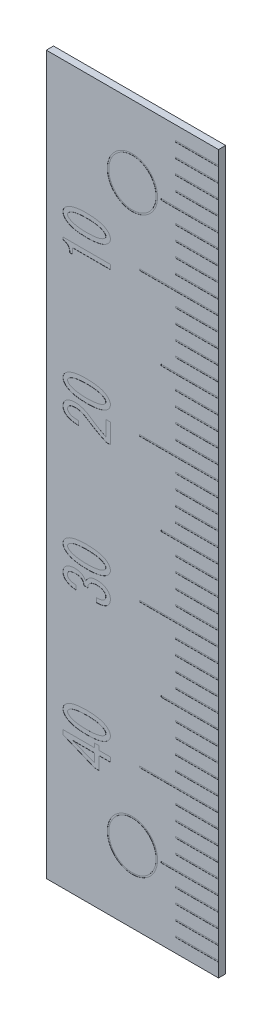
SolidWorks part; units mm, degrees
ref_plane "Front" through (0, 0, 0) normal (0, 0, 1) x (1, 0, 0)
ref_plane "Top" through (0, 0, 0) normal (0, 1, 0) x (1, 0, 0)
ref_plane "Right" through (0, 0, 0) normal (1, 0, 0) x (0, 0, -1)
sketch "Sketch1" plane through (0, 0, 0) normal (0, 0, 1) x (1, 0, 0)
  line L1 (0, 0) -> (0, 50)
  line L2 (0, 0) -> (12, 0)
  line L3 (12, 0) -> (12, 50)
  line L4 (0, 50) -> (12, 50)
  dimension "D1" = 50
  dimension "D2" = 12
extrude "Extrude1" add sketch "Sketch1" along normal blind 0.5
sketch "Sketch2" plane through (0, 0, 0.5) normal (0, 0, 1) x (1, 0, 0)
  line L0 (0, 50) -> (0, 0) construction
  line L1 (0, 0) -> (12, 0) construction
  line L2 (12, 50) -> (0, 50) construction
  circle A0 centre (6, 5) radius 1.75
  circle A1 centre (6, 45) radius 1.75
  circle A2 centre (6, 5) radius 1.65
  circle A3 centre (6, 45) radius 1.65
  dimension "D1" = 6
  dimension "D2" = 6
  dimension "D3" = 5
  dimension "D4" = 5
  dimension "D5" = 3.5
  dimension "D6" = 3.5
  dimension "D7" = 0.1
extrude "Extrude2" cut sketch "Sketch2" against normal blind 0.01
sketch "Sketch3" plane through (0, 0, 0.5) normal (0, 0, 1) x (1, 0, 0)
  line L0 (12, 50) -> (0, 50) construction
  line L1 (1, 38.25) -> (4.5, 38.25) construction
  line L2 (1, 38.25) -> (1, 41.75) construction
  line L3 (1, 41.75) -> (4.5, 41.75) construction
  line L4 (4.5, 38.25) -> (4.5, 41.75) construction
  line L5 (0, 50) -> (0, 0) construction
  line L6 (4.5, 28.25) -> (4.5, 31.75) construction
  line L7 (4.5, 18.25) -> (4.5, 21.75) construction
  line L8 (4.5, 8.25) -> (4.5, 11.75) construction
  text T0 "10" font "ＭＳ ゴシック" height in points 11
  text T1 "20" font "ＭＳ ゴシック" height in points 11
  text T2 "30" font "ＭＳ ゴシック" height in points 11
  text T3 "40" font "ＭＳ ゴシック" height in points 11
  point P4 (4.5, 40)
  dimension "D1" = 3.5
  dimension "D2" = 10
  dimension "D3" = 1
  dimension "D4" = 3.5
  dimension "D5" = 4
extrude "Extrude3" cut sketch "Sketch3" against normal blind 0.01
sketch "Sketch4" plane through (0, 0, 0.5) normal (0, 0, 1) x (1, 0, 0)
  line L0 (12, 40.05) -> (6.5, 40.05)
  line L1 (12, 0) -> (12, 50) construction
  line L2 (6.5, 40.05) -> (6.5, 39.95)
  line L3 (6.5, 39.95) -> (12, 39.95)
  line L4 (12, 39.95) -> (12, 40.05)
  line L5 (12, 50) -> (0, 50) construction
  line L6 (12, 48.05) -> (12, 47.95)
  line L7 (12, 44.95) -> (8, 44.95)
  line L8 (12, 44.95) -> (12, 45.05)
  line L9 (12, 45.05) -> (8, 45.05)
  line L10 (8, 44.95) -> (8, 45.05)
  line L11 (12, 49.05) -> (9, 49.05)
  line L12 (12, 49.05) -> (12, 48.95)
  line L13 (12, 48.95) -> (9, 48.95)
  line L14 (9, 49.05) -> (9, 48.95)
  line L15 (12, 48.05) -> (9, 48.05)
  line L16 (12, 47.95) -> (9, 47.95)
  line L17 (9, 48.05) -> (9, 47.95)
  line L18 (12, 47.05) -> (12, 46.95)
  line L19 (12, 47.05) -> (9, 47.05)
  line L20 (12, 46.95) -> (9, 46.95)
  line L21 (9, 47.05) -> (9, 46.95)
  line L22 (12, 46.05) -> (12, 45.95)
  line L23 (12, 46.05) -> (9, 46.05)
  line L24 (12, 45.95) -> (9, 45.95)
  line L25 (9, 46.05) -> (9, 45.95)
  line L26 (12, 30.05) -> (6.5, 30.05)
  line L27 (6.5, 30.05) -> (6.5, 29.95)
  line L28 (6.5, 29.95) -> (12, 29.95)
  line L29 (12, 29.95) -> (12, 30.05)
  line L30 (12, 44.05) -> (12, 43.95)
  line L31 (12, 44.05) -> (9, 44.05)
  line L32 (12, 43.95) -> (9, 43.95)
  line L33 (9, 44.05) -> (9, 43.95)
  line L34 (12, 43.05) -> (12, 42.95)
  line L35 (12, 43.05) -> (9, 43.05)
  line L36 (12, 42.95) -> (9, 42.95)
  line L37 (9, 43.05) -> (9, 42.95)
  line L38 (12, 42.05) -> (12, 41.95)
  line L39 (12, 42.05) -> (9, 42.05)
  line L40 (12, 41.95) -> (9, 41.95)
  line L41 (9, 42.05) -> (9, 41.95)
  line L42 (12, 41.05) -> (12, 40.95)
  line L43 (12, 41.05) -> (9, 41.05)
  line L44 (12, 40.95) -> (9, 40.95)
  line L45 (9, 41.05) -> (9, 40.95)
  line L46 (9, 45.05) -> (9, 44.95)
  line L47 (12, 45.05) -> (9, 45.05)
  line L48 (12, 44.95) -> (9, 44.95)
  line L49 (12, 45.05) -> (12, 44.95)
  line L50 (12, 38.05) -> (12, 37.95)
  line L51 (12, 34.95) -> (8, 34.95)
  line L52 (12, 34.95) -> (12, 35.05)
  line L53 (12, 35.05) -> (8, 35.05)
  line L54 (8, 34.95) -> (8, 35.05)
  line L55 (12, 39.05) -> (9, 39.05)
  line L56 (12, 39.05) -> (12, 38.95)
  line L57 (12, 38.95) -> (9, 38.95)
  line L58 (9, 39.05) -> (9, 38.95)
  line L59 (12, 38.05) -> (9, 38.05)
  line L60 (12, 37.95) -> (9, 37.95)
  line L61 (9, 38.05) -> (9, 37.95)
  line L62 (12, 37.05) -> (12, 36.95)
  line L63 (12, 37.05) -> (9, 37.05)
  line L64 (12, 36.95) -> (9, 36.95)
  line L65 (9, 37.05) -> (9, 36.95)
  line L66 (12, 36.05) -> (12, 35.95)
  line L67 (12, 36.05) -> (9, 36.05)
  line L68 (12, 35.95) -> (9, 35.95)
  line L69 (9, 36.05) -> (9, 35.95)
  line L70 (12, 34.05) -> (12, 33.95)
  line L71 (12, 34.05) -> (9, 34.05)
  line L72 (12, 33.95) -> (9, 33.95)
  line L73 (9, 34.05) -> (9, 33.95)
  line L74 (12, 33.05) -> (12, 32.95)
  line L75 (12, 33.05) -> (9, 33.05)
  line L76 (12, 32.95) -> (9, 32.95)
  line L77 (9, 33.05) -> (9, 32.95)
  line L78 (12, 32.05) -> (12, 31.95)
  line L79 (12, 32.05) -> (9, 32.05)
  line L80 (12, 31.95) -> (9, 31.95)
  line L81 (9, 32.05) -> (9, 31.95)
  line L82 (12, 31.05) -> (12, 30.95)
  line L83 (12, 31.05) -> (9, 31.05)
  line L84 (12, 30.95) -> (9, 30.95)
  line L85 (9, 31.05) -> (9, 30.95)
  line L86 (12, 20.05) -> (6.5, 20.05)
  line L87 (6.5, 20.05) -> (6.5, 19.95)
  line L88 (6.5, 19.95) -> (12, 19.95)
  line L89 (12, 19.95) -> (12, 20.05)
  line L90 (12, 28.05) -> (12, 27.95)
  line L91 (12, 24.95) -> (8, 24.95)
  line L92 (12, 24.95) -> (12, 25.05)
  line L93 (12, 25.05) -> (8, 25.05)
  line L94 (8, 24.95) -> (8, 25.05)
  line L95 (12, 29.05) -> (9, 29.05)
  line L96 (12, 29.05) -> (12, 28.95)
  line L97 (12, 28.95) -> (9, 28.95)
  line L98 (9, 29.05) -> (9, 28.95)
  line L99 (12, 28.05) -> (9, 28.05)
  line L100 (12, 27.95) -> (9, 27.95)
  line L101 (9, 28.05) -> (9, 27.95)
  line L102 (12, 27.05) -> (12, 26.95)
  line L103 (12, 27.05) -> (9, 27.05)
  line L104 (12, 26.95) -> (9, 26.95)
  line L105 (9, 27.05) -> (9, 26.95)
  line L106 (12, 26.05) -> (12, 25.95)
  line L107 (12, 26.05) -> (9, 26.05)
  line L108 (12, 25.95) -> (9, 25.95)
  line L109 (9, 26.05) -> (9, 25.95)
  line L110 (12, 24.05) -> (12, 23.95)
  line L111 (12, 24.05) -> (9, 24.05)
  line L112 (12, 23.95) -> (9, 23.95)
  line L113 (9, 24.05) -> (9, 23.95)
  line L114 (12, 23.05) -> (12, 22.95)
  line L115 (12, 23.05) -> (9, 23.05)
  line L116 (12, 22.95) -> (9, 22.95)
  line L117 (9, 23.05) -> (9, 22.95)
  line L118 (12, 22.05) -> (12, 21.95)
  line L119 (12, 22.05) -> (9, 22.05)
  line L120 (12, 21.95) -> (9, 21.95)
  line L121 (9, 22.05) -> (9, 21.95)
  line L122 (12, 21.05) -> (12, 20.95)
  line L123 (12, 21.05) -> (9, 21.05)
  line L124 (12, 20.95) -> (9, 20.95)
  line L125 (9, 21.05) -> (9, 20.95)
  line L126 (12, 10.05) -> (6.5, 10.05)
  line L127 (6.5, 10.05) -> (6.5, 9.95)
  line L128 (6.5, 9.95) -> (12, 9.95)
  line L129 (12, 9.95) -> (12, 10.05)
  line L130 (12, 18.05) -> (12, 17.95)
  line L131 (12, 14.95) -> (8, 14.95)
  line L132 (12, 14.95) -> (12, 15.05)
  line L133 (12, 15.05) -> (8, 15.05)
  line L134 (8, 14.95) -> (8, 15.05)
  line L135 (12, 19.05) -> (9, 19.05)
  line L136 (12, 19.05) -> (12, 18.95)
  line L137 (12, 18.95) -> (9, 18.95)
  line L138 (9, 19.05) -> (9, 18.95)
  line L139 (12, 18.05) -> (9, 18.05)
  line L140 (12, 17.95) -> (9, 17.95)
  line L141 (9, 18.05) -> (9, 17.95)
  line L142 (12, 17.05) -> (12, 16.95)
  line L143 (12, 17.05) -> (9, 17.05)
  line L144 (12, 16.95) -> (9, 16.95)
  line L145 (9, 17.05) -> (9, 16.95)
  line L146 (12, 16.05) -> (12, 15.95)
  line L147 (12, 16.05) -> (9, 16.05)
  line L148 (12, 15.95) -> (9, 15.95)
  line L149 (9, 16.05) -> (9, 15.95)
  line L150 (12, 14.05) -> (12, 13.95)
  line L151 (12, 14.05) -> (9, 14.05)
  line L152 (12, 13.95) -> (9, 13.95)
  line L153 (9, 14.05) -> (9, 13.95)
  line L154 (12, 13.05) -> (12, 12.95)
  line L155 (12, 13.05) -> (9, 13.05)
  line L156 (12, 12.95) -> (9, 12.95)
  line L157 (9, 13.05) -> (9, 12.95)
  line L158 (12, 12.05) -> (12, 11.95)
  line L159 (12, 12.05) -> (9, 12.05)
  line L160 (12, 11.95) -> (9, 11.95)
  line L161 (9, 12.05) -> (9, 11.95)
  line L162 (12, 11.05) -> (12, 10.95)
  line L163 (12, 11.05) -> (9, 11.05)
  line L164 (12, 10.95) -> (9, 10.95)
  line L165 (9, 11.05) -> (9, 10.95)
  line L170 (12, 8.05) -> (12, 7.95)
  line L171 (12, 4.95) -> (8, 4.95)
  line L172 (12, 4.95) -> (12, 5.05)
  line L173 (12, 5.05) -> (8, 5.05)
  line L174 (8, 4.95) -> (8, 5.05)
  line L175 (12, 9.05) -> (9, 9.05)
  line L176 (12, 9.05) -> (12, 8.95)
  line L177 (12, 8.95) -> (9, 8.95)
  line L178 (9, 9.05) -> (9, 8.95)
  line L179 (12, 8.05) -> (9, 8.05)
  line L180 (12, 7.95) -> (9, 7.95)
  line L181 (9, 8.05) -> (9, 7.95)
  line L182 (12, 7.05) -> (12, 6.95)
  line L183 (12, 7.05) -> (9, 7.05)
  line L184 (12, 6.95) -> (9, 6.95)
  line L185 (9, 7.05) -> (9, 6.95)
  line L186 (12, 6.05) -> (12, 5.95)
  line L187 (12, 6.05) -> (9, 6.05)
  line L188 (12, 5.95) -> (9, 5.95)
  line L189 (9, 6.05) -> (9, 5.95)
  line L190 (12, 4.05) -> (12, 3.95)
  line L191 (12, 4.05) -> (9, 4.05)
  line L192 (12, 3.95) -> (9, 3.95)
  line L193 (9, 4.05) -> (9, 3.95)
  line L194 (12, 3.05) -> (12, 2.95)
  line L195 (12, 3.05) -> (9, 3.05)
  line L196 (12, 2.95) -> (9, 2.95)
  line L197 (9, 3.05) -> (9, 2.95)
  line L198 (12, 2.05) -> (12, 1.95)
  line L199 (12, 2.05) -> (9, 2.05)
  line L200 (12, 1.95) -> (9, 1.95)
  line L201 (9, 2.05) -> (9, 1.95)
  line L202 (12, 1.05) -> (12, 0.95)
  line L203 (12, 1.05) -> (9, 1.05)
  line L204 (12, 0.95) -> (9, 0.95)
  line L205 (9, 1.05) -> (9, 0.95)
  line L206 (12, 0.05) -> (6.5, 0.05)
  line L207 (6.5, 0.05) -> (6.5, -0.05)
  line L208 (6.5, -0.05) -> (12, -0.05)
  line L209 (12, -0.05) -> (12, 0.05)
  point P4 (12, 40)
  point P13 (12, 45)
  point P18 (12, 49)
  dimension "D1" = 10
  dimension "D2" = 0.1
  dimension "D3" = 5.5
  dimension "D4" = 5
  dimension "D5" = 0.1
  dimension "D6" = 1
  dimension "D7" = 0.1
  dimension "D8" = 3
  dimension "D9" = 4
  dimension "D10" = 9
  dimension "D11" = 5
extrude "Extrude4" cut sketch "Sketch4" against normal blind 0.01
move or copy body "Body-Move/Copy2" bodies to move or copy 105 copy no translate (-12, -50, 0)
